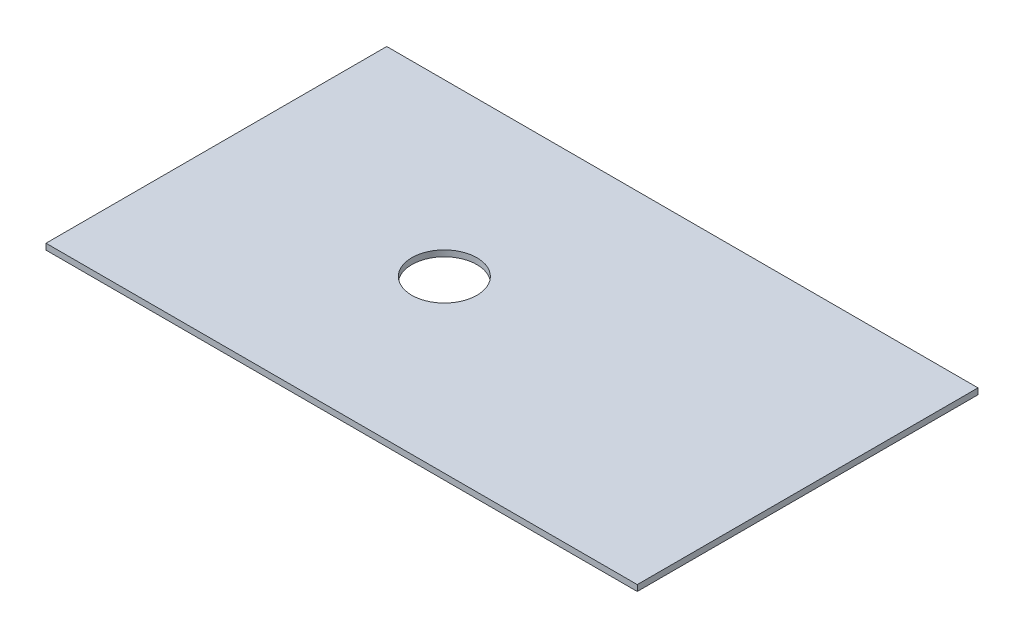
SolidWorks part; units mm, degrees
ref_plane "Front Plane" through (0, 0, 0) normal (0, 0, 1) x (1, 0, 0)
ref_plane "Top Plane" through (0, 0, 0) normal (0, 1, 0) x (1, 0, 0)
ref_plane "Right Plane" through (0, 0, 0) normal (1, 0, 0) x (0, 0, -1)
sketch "Sketch1" plane through (0, 0, 0) normal (0, 1, 0) x (1, 0, 0)
  line L1 (-590, -340) -> (590, -340)
  line L2 (-590, -340) -> (-590, 340)
  line L3 (-590, 340) -> (590, 340)
  line L4 (590, -340) -> (590, 340)
  line L5 (-590, -340) -> (590, 340) construction
  line L6 (-590, 340) -> (590, -340) construction
  point P0 (0, 0)
  dimension "D1" = 680
  dimension "D2" = 1180
extrude "Boss-Extrude1" add sketch "Sketch1" along normal mid plane 12
sketch "Sketch2" plane through (0, 6, 0) normal (0, 1, 0) x (1, 0, 0)
  circle A0 centre (-135, 0) radius 65
  circle A1 centre (-135, 0) radius 17 construction
  dimension "D1" = 130
extrude "Cut-Extrude1" cut sketch "Sketch2" against normal up to next
